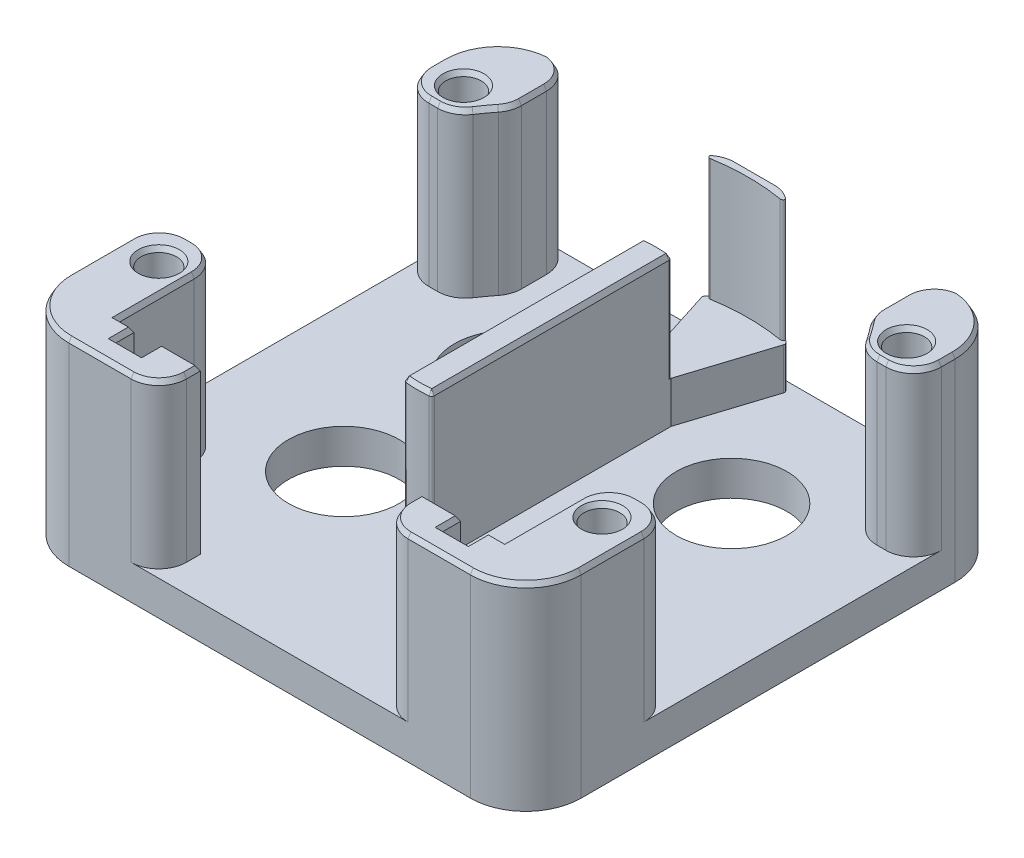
SolidWorks part; units mm, degrees
ref_plane "Front" through (0, 0, 0) normal (0, 0, 1) x (1, 0, 0)
ref_plane "Top" through (0, 0, 0) normal (0, 1, 0) x (1, 0, 0)
ref_plane "Right" through (0, 0, 0) normal (1, 0, 0) x (0, 0, -1)
ref_plane "Front-WURTH_7448262510" through (0, 14.675, -3) normal (0, 0, 1) x (1, 0, 0)
ref_plane "Top-WURTH_7448262510" through (0, 14.675, -3) normal (0, 1, 0) x (1, 0, 0)
ref_plane "Right-WURTH_7448262510" through (0, 14.675, -3) normal (1, 0, 0) x (0, 0, -1)
ref_plane "base_thickness" through (0, 3.175, 0) normal (0, 1, 0) x (1, 0, 0)
ref_plane "extrude_split" through (0, 18.175, 0) normal (0, 1, 0) x (1, 0, 0)
inserted part "WURTH_7448262510"
move or copy body "Body-Move/Copy2"
sketch "Sketch1" plane through (0, 0, 0) normal (0, 1, 0) x (1, 0, 0)
  line L0 (0, -954.6224) -> (0, 49045.3776) construction
  line L1 (-50, 0) -> (50, 0) construction
  line L2 (-23.495, 40.64) -> (0, 40.64)
  line L3 (-23.495, 40.64) -> (-23.495, -3.81)
  line L4 (-23.495, -3.81) -> (0, -3.81)
  line L5 (0, 40.64) -> (0, -3.81)
  line L7 (-4.445, 28.7654) -> (-5.7651, 13.6768) construction
  line L8 (-2.032, 29.6899) -> (-3.5493, 12.3474) construction
  line L14 (-17.5, 0) -> (17.5, 0) construction
  line L15 (-17.5, 0) -> (-17.5, 3) construction
  line L16 (-17.5, 3) -> (17.5, 3) construction
  line L17 (17.5, 0) -> (17.5, 3) construction
  circle A0 centre (0, 20.7745) radius 9.144 construction
  circle A1 centre (0, 20.7745) radius 21.463 construction
  circle A3 centre (-20.32, 34.29) radius 1.6319 construction
  circle A4 centre (-20.32, 6.35) radius 1.632 construction
  dimension "D5" = 42.926
  dimension "D6" = 18.288
  dimension "D7" = 3.2639
  dimension "D1" = 40.64
  dimension "D2" = 46.99
  dimension "D3" = 3.81
  dimension "D4" = 20.7745
  dimension "D8" = 40.64
  dimension "D9" = 5
  dimension "D10" = 2.032
  dimension "D11" = 4.445
  dimension "D12" = 35
  dimension "D13" = 27.94
  dimension "D14" = 3
  dimension "D15" = 6.35
extrude "Boss-Extrude1" add sketch "Sketch1" along normal up to surface (3.175 mm away)
sketch "Sketch2" plane through (0, 0, 0) normal (0, 1, 0) x (1, 0, 0)
  line L0 (-17.754, 9.5706) -> (-17.754, 0)
  line L1 (-17.754, 0) -> (-16.256, 0)
  line L3 (-10.16, 0) -> (-10.16, -3.81)
  line L5 (-23.495, 40.64) -> (-23.495, -3.81) construction
  line L6 (-23.495, -3.81) -> (0, -3.81) construction
  line L7 (-17.5, 0) -> (-17.5, 3) construction
  line L8 (-17.5, 0) -> (17.5, 0) construction
  line L9 (0, -200954.6224) -> (0, 249045.3776) construction
  line L10 (-16.256, 0) -> (-16.256, -1.8387)
  line L11 (-16.256, -1.8387) -> (-13.716, -1.8387)
  line L12 (-13.716, -1.8387) -> (-13.716, 0)
  line L13 (-13.716, 0) -> (-10.16, 0)
  line L14 (-23.495, 9.5706) -> (-17.754, 9.5706)
  line L16 (-23.495, 9.5706) -> (-23.495, -3.81)
  line L17 (-23.495, -3.81) -> (-10.16, -3.81)
  dimension "D3" = 0.254
  dimension "D4" = 0
  dimension "D5" = 10.16
  dimension "D6" = 13.716
  dimension "D7" = 2.54
  dimension "D8" = 1.8387
extrude "Boss-Extrude2" add sketch "Sketch2" along normal up to surface (18.175 mm away)
sketch "Sketch3" plane through (0, 0, 0) normal (0, 1, 0) x (1, 0, 0)
  line L0 (0, -200954.6224) -> (0, 249045.3776) construction
  line L2 (-1.27, 31.7503) -> (-1.27, 9.7987)
  line L4 (0, 31.8235) -> (0, 9.7255)
  arc A0 (-1.27, 31.7503) -> (0, 31.8235) centre (0, 20.7745) cw
  arc A1 (-1.27, 9.7987) -> (0, 9.7255) centre (0, 20.7745) ccw
  dimension "D1" = 11.049
  dimension "D2" = 1.27
extrude "Boss-Extrude3" add sketch "Sketch3" along normal offset from surface (16.905 mm away) 1.27
sketch "Sketch4" plane through (0, 0, 0) normal (0, 1, 0) x (1, 0, 0)
  line L0 (-3.81, 40.64) -> (-3.81, 39.6988)
  line L1 (-23.495, 40.64) -> (0, 40.64) construction
  line L3 (0, 40.64) -> (0, -3.81) construction
  line L4 (0, 40.0785) -> (0, 40.64)
  line L5 (0, 40.64) -> (-3.81, 40.64)
  line L6 (0, -200954.6224) -> (0, 249045.3776) construction
  arc A0 (-3.81, 39.6988) -> (0, 40.0785) centre (0, 20.7745) cw
  dimension "D2" = 19.304
  dimension "D1" = 3.81
extrude "Boss-Extrude4" add sketch "Sketch4" along normal up to surface (18.175 mm away)
sketch "Sketch5" plane through (0, 0, 0) normal (0, 1, 0) x (1, 0, 0)
  line L0 (-3.81, 39.6988) -> (-1.27, 31.7503)
  line L1 (0, 40.0785) -> (0, 31.8235)
  arc A0 (0, 31.8235) -> (-1.27, 31.7503) centre (0, 20.7745) ccw construction
  arc A1 (0, 40.0785) -> (-3.81, 39.6988) centre (0, 20.7745) ccw construction
  arc A2 (0, 31.8235) -> (-1.27, 31.7503) centre (0, 20.7745) ccw
  arc A3 (0, 40.0785) -> (-3.81, 39.6988) centre (0, 20.7745) ccw
extrude "Boss-Extrude5" add sketch "Sketch5" along normal blind 7
sketch "Sketch7" plane through (0, 0, 0) normal (0, 1, 0) x (1, 0, 0)
  line L0 (-23.495, 40.64) -> (-16.51, 40.64)
  line L1 (-23.495, 40.64) -> (0, 40.64) construction
  line L2 (-16.51, 40.64) -> (-16.51, 34.8829)
  line L4 (-18.7394, 31.75) -> (-23.495, 31.75)
  line L5 (-23.495, 40.64) -> (-23.495, -3.81) construction
  line L6 (-23.495, 31.75) -> (-23.495, 40.64)
  circle A0 centre (0, 20.7745) radius 21.463 construction
  arc A1 (-16.51, 34.8829) -> (-18.7394, 31.75) centre (0, 20.7745) ccw
  dimension "D1" = 0.254
  dimension "D2" = 2.54
  dimension "D3" = 3.81
extrude "Boss-Extrude6" add sketch "Sketch7" along normal up to surface (18.175 mm away)
sketch "Sketch11" plane through (0, 0, 0) normal (0, 1, 0) x (1, 0, 0)
  line L0 (-10.16, 28.3945) -> (-10.16, 13.1545) construction
  line L1 (0, 20.7745) -> (-10.16, 20.7745) construction
  line L2 (0, -50) -> (0, 50) construction
  circle A0 centre (-10.16, 28.3945) radius 5.08
  circle A1 centre (-10.16, 13.1545) radius 5.08
  dimension "D2" = 10.16
  dimension "D4" = 10.16
  dimension "D6" = 15.24
extrude "Cut-Extrude1" cut sketch "Sketch11" along normal through all both and the other way through all
hole_wizard "#4 Clearance Hole1" positions "Sketch9" profile "Sketch10" hole size "#4" standard "ANSI Inch"
sketch "Sketch9" plane through (0, 0, 0) normal (0, -1, 0) x (-1, 0, 0)
  point P0 (20.32, 34.29)
  point P3 (20.32, 6.35)
sketch "Sketch10" plane through (-20.32, 0, -34.29) normal (1, 0, 0) x (0, 0, -1)
  line L0 (0, 0) -> (0, 18.175)
  line L1 (0, 18.175) -> (1.6319, 18.175)
  line L2 (1.6319, 18.175) -> (1.6319, 0)
  line L5 (1.6319, 0) -> (0, 0)
  line L11 (0, -6.35) -> (0, 107.95) construction
  dimension "Thru Hole Dia." = 3.2639
  dimension "Thru Hole Depth" = 18.175
fillet "Fillet1" radius 2.54 8 edges at (-10.16, 10.675, 3.81) (-3.81, 10.675, -40.64) (-23.495, 10.675, -31.75) (-16.51, 10.675, -40.64) (-23.495, 10.675, -9.5706) (-17.754, 10.675, -9.5706) (-16.51, 10.675, -34.8829) (-18.7394, 10.675, -31.75)
fillet "Fillet2" radius 5.08 2 edges at (-23.495, 9.0875, -40.64) (-23.495, 9.0875, 3.81)
chamfer "Chamfer2" distance 0.508 angle 45 1 edges at (-3.81, 12.5875, -39.6988)
fillet "Fillet3" radius 0.254 2 edges at (-3.81, 5.0875, -39.6988) (-3.4559, 12.5875, -39.7666)
fillet "Fillet4" radius 0.254 2 edges at (-1.27, 11.9525, -31.7503) (-1.27, 10.04, -9.7987)
chamfer "Chamfer3" distance 0.254 angle 60 30 edges at (-20.32, 18.175, -7.9819) (-20.32, 18.175, -35.9219) (-17.005, 18.175, 0) (-16.256, 18.175, 0.9193) (-14.986, 18.175, 1.8387) (-13.716, 18.175, 0.9193) (-11.938, 18.175, 0) (-17.754, 18.175, -3.5153) (-18.4979, 18.175, -8.8267) (-20.6245, 18.175, -9.5706) (-10.16, 18.175, 0.635) (-22.7511, 18.175, -8.8267) (-10.9039, 18.175, 3.0661) (-23.495, 18.175, -4.1503) (-15.5575, 18.175, 3.81) (-22.0071, 18.175, 2.3221) (-23.495, 18.175, -34.925) (-22.7511, 18.175, -32.4939) (-22.1363, 18.175, -39.0181) (-20.5489, 18.175, -31.75) (-17.1633, 18.175, -39.8006) (-16.51, 18.175, -36.9456) (-0.5205, 16.905, -9.7378) (-0.5205, 16.905, -31.8112) (-1.2039, 16.905, -31.6925) (-1.2039, 16.905, -9.8565) (-1.27, 16.905, -20.7745) (-18.9476, 18.175, -32.0488) (-17.5573, 18.175, -33.5561) (-16.6502, 18.175, -34.959)
mirror "Mirror1" about plane through (0, 0, 0) normal (1, 0, 0)
